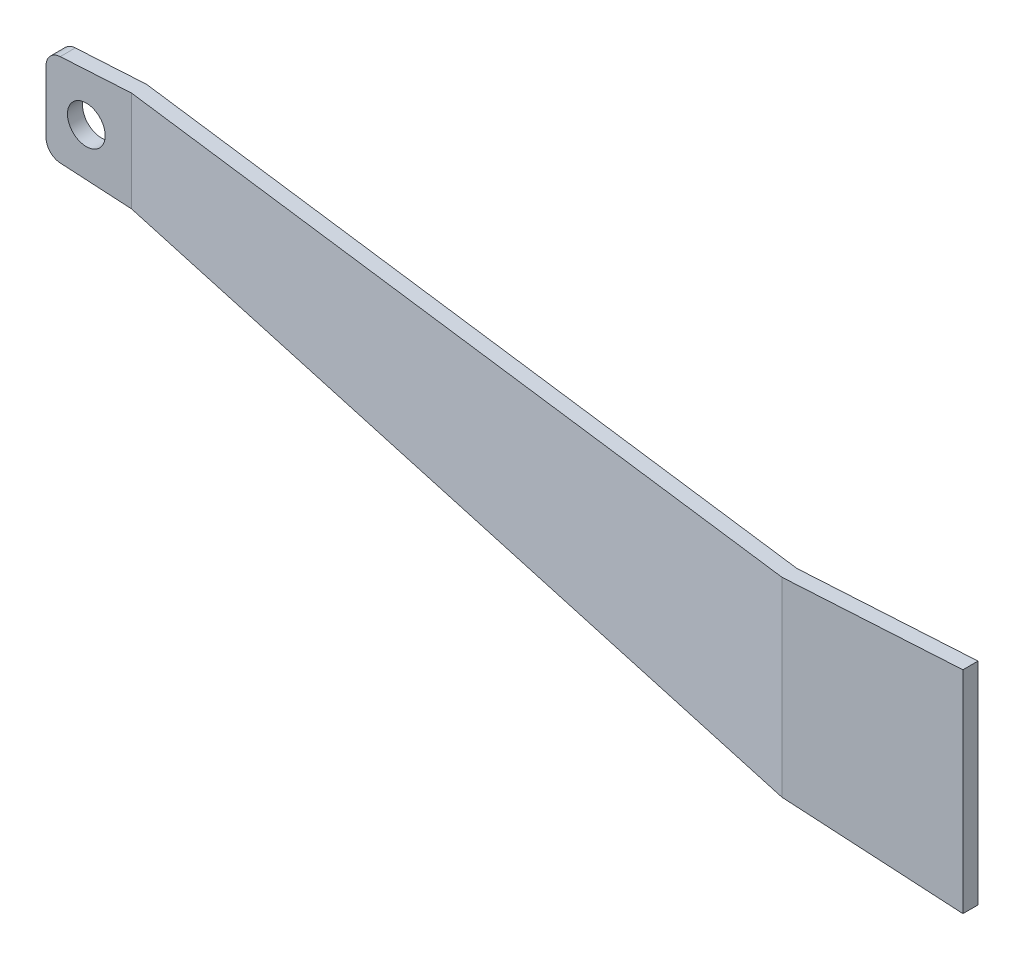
SolidWorks part; units mm, degrees
ref_plane "Plan1" through (0, 0, 0) normal (0, 0, 1) x (1, 0, 0)
ref_plane "Plan2" through (0, 0, 0) normal (0, 1, 0) x (1, 0, 0)
ref_plane "Plan3" through (0, 0, 0) normal (1, 0, 0) x (0, 0, -1)
ref_plane "Plan4" through (0, 0, 4.5) normal (0, 0, 1) x (1, 0, 0)
sketch "Esquisse1" plane through (0, 0, 4.5) normal (0, 0, 1) x (1, 0, 0)
  line L0 (459.9283, -167.7664) -> (389.9283, -171.7664)
  line L1 (389.9283, -171.7664) -> (389.9283, -177.7664)
  line L2 (389.9283, -177.7664) -> (459.9283, -181.7664)
  line L3 (459.9283, -181.7664) -> (459.9283, -167.7664)
extrude "Base-Extrusion" add sketch "Esquisse1" against normal blind 10.227
imported_body "Surface-Importée1"
thicken "Enlèvement de matière-épaissir1"
imported_body "Surface-Importée2"
thicken "Enlèvement de matière-épaissir2"
fillet "Congé1" radius 1
hole_wizard "Perçage1" positions "Esquisse4" profile "Esquisse3" legacy
sketch "Esquisse4" plane through (0, 0, -4.727) normal (0, 0, 1) x (1, 0, 0)
  point P0 (392.5996, -174.7655)
  dimension "D1" = 3
  dimension "D2" = 3.325
sketch "Esquisse3" plane through (392.5996, -174.7655, -4.727) normal (1, 0, 0) x (0, -1, 0)
  line L0 (0, 0) -> (0, 1)
  line L1 (0, 1) -> (1.25, 1)
  line L2 (1.25, 1) -> (1.25, 0)
  line L3 (1.25, 0) -> (0, 0)
  line L4 (0, 110) -> (0, -10) construction
  dimension "Diamètre" = 2.5
  dimension "Profondeur" = 1
